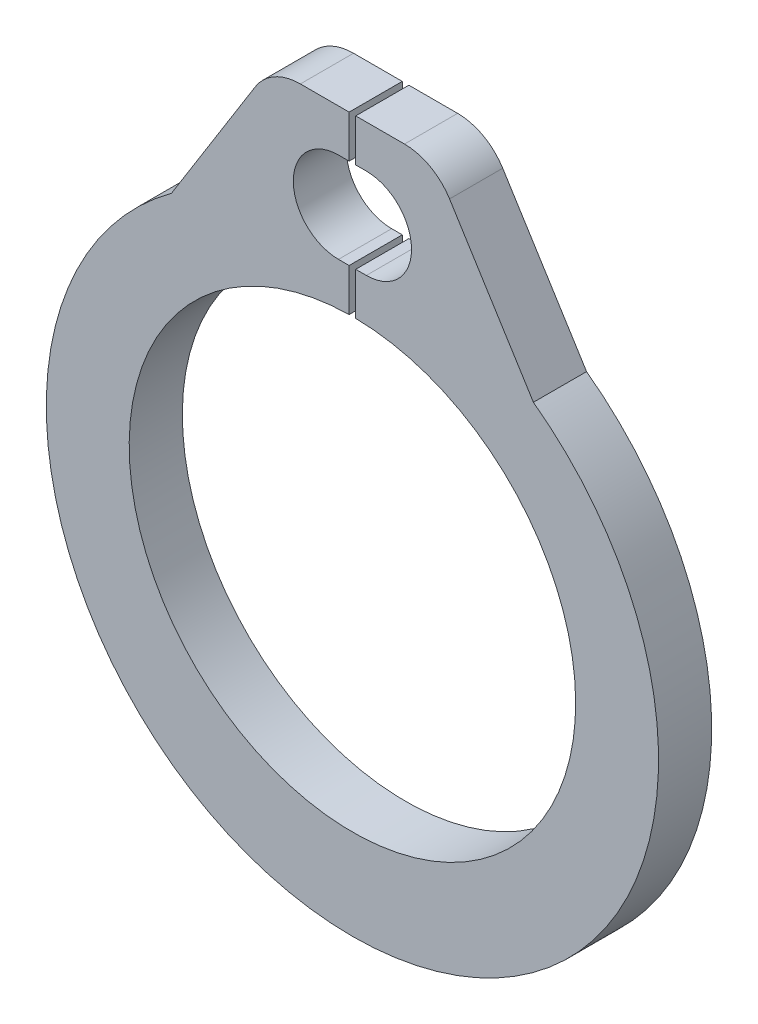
SolidWorks part; units mm, degrees
ref_plane "Front" through (0, 0, 0) normal (0, 0, 1) x (1, 0, 0)
ref_plane "Top" through (0, 0, 0) normal (0, 1, 0) x (1, 0, 0)
ref_plane "Right" through (0, 0, 0) normal (1, 0, 0) x (0, 0, -1)
sketch "Sketch1" plane through (0, 0, 0) normal (0, 0, 1) x (1, 0, 0)
  line L0 (-0.264, 4.1229) -> (-0.264, 4.9234)
  line L1 (-1.3052, 7.4229) -> (-0.3878, 7.4229)
  line L3 (-0.3259, -0.0766) -> (-0.3259, 7.1992) construction
  line L4 (-0.3878, 4.1229) -> (-0.3878, 4.9234)
  line L5 (0.6534, 7.4229) -> (-0.264, 7.4229)
  line L7 (-5.9635, -0.2171) -> (5.6408, -0.2171) construction
  line L8 (-0.3259, -0.0766) -> (-0.3259, -1.3097) construction
  line L9 (3.0792, 4.428) -> (1.5015, 6.9528)
  line L10 (-3.731, 4.428) -> (-2.1533, 6.9528)
  line L11 (-0.5878, 6.6234) -> (-0.3878, 6.6234)
  line L12 (-0.5878, 4.9234) -> (-0.3878, 4.9234)
  line L13 (-0.264, 6.6234) -> (-0.264, 7.4229)
  line L14 (-0.3878, 6.6234) -> (-0.3878, 7.4229)
  line L15 (-0.264, 4.9234) -> (-0.064, 4.9234)
  line L16 (-0.264, 6.6234) -> (-0.064, 6.6234)
  arc A0 (-0.5878, 6.6234) -> (-0.5878, 4.9234) centre (-0.5878, 5.7734) ccw
  arc A1 (-0.3878, 4.1229) -> (-0.264, 4.1229) centre (-0.3259, -0.0766) ccw
  arc A2 (-3.731, 4.428) -> (3.0792, 4.428) centre (-0.3259, -0.2171) ccw
  arc A3 (1.5015, 6.9528) -> (0.6534, 7.4229) centre (0.6534, 6.4229) ccw
  arc A4 (-1.3052, 7.4229) -> (-2.1533, 6.9528) centre (-1.3052, 6.4229) ccw
  circle A6 centre (-0.3259, -0.0766) radius 4.6 construction
  arc A7 (-0.064, 6.6234) -> (-0.064, 4.9234) centre (-0.064, 5.7734) cw
  point P27 (1.2077, 7.4229)
  point P30 (-1.8596, 7.4229)
  dimension "D1" = 32
  dimension "D2" = 8.4
  dimension "D4" = 1.7
  dimension "D3" = 3.3
  dimension "D6" = 1.7
  dimension "D8" = 9.2
  dimension "D9" = 5.85
  dimension "D10" = 1
  dimension "D5" = 0.2
  dimension "D7" = 1.4717
extrude "Base-Extrude" add sketch "Sketch1" along normal blind 1
